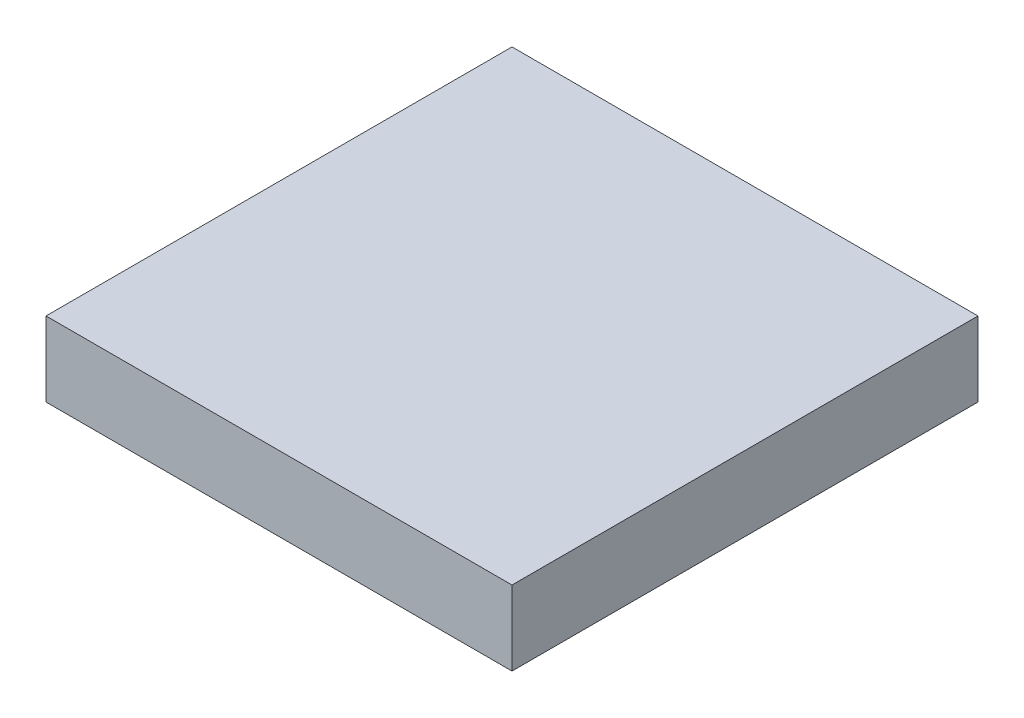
SolidWorks part; units mm, degrees
ref_plane "Front" through (0, 0, 0) normal (0, 0, 1) x (1, 0, 0)
ref_plane "Top" through (0, 0, 0) normal (0, 1, 0) x (1, 0, 0)
ref_plane "Right" through (0, 0, 0) normal (1, 0, 0) x (0, 0, -1)
sketch "Sketch1" plane through (0, 0, 0) normal (0, 1, 0) x (1, 0, 0)
  line L0 (-50, 50) -> (50, -50) construction
  line L1 (-50, 50) -> (50, 50)
  line L2 (-50, 50) -> (-50, -50)
  line L3 (-50, -50) -> (50, -50)
  line L4 (50, 50) -> (50, -50)
  dimension "D1" = 100
extrude "Base-Extrude" add sketch "Sketch1" along normal blind 16
